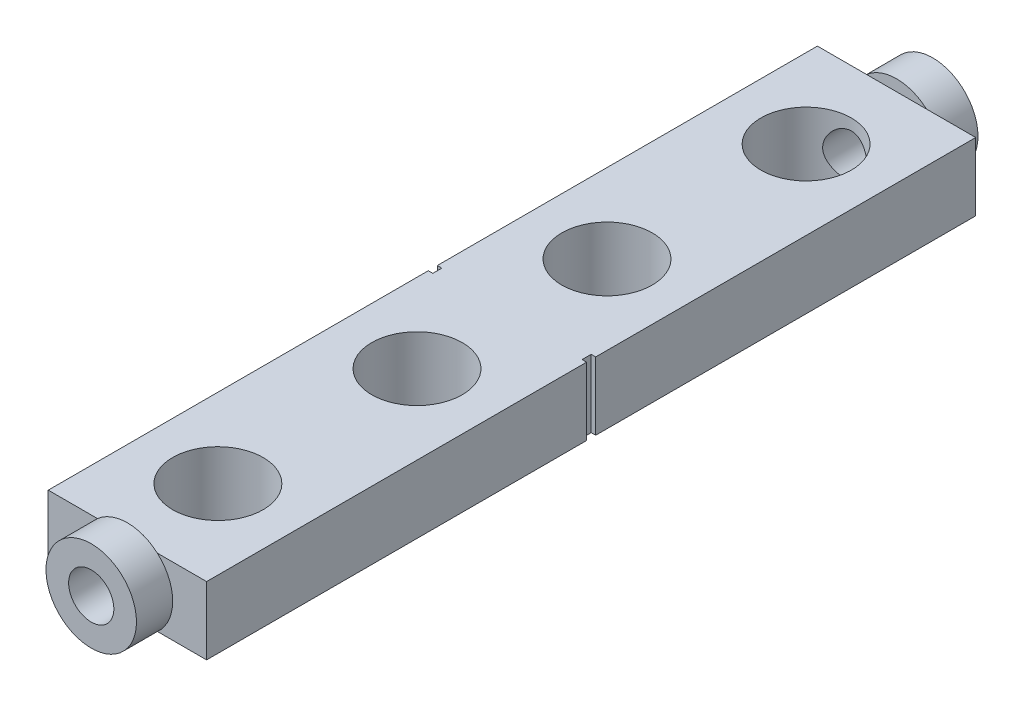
SolidWorks part; units mm, degrees
ref_plane "Face" through (0, 0, 0) normal (0, 0, 1) x (1, 0, 0)
ref_plane "Dessus" through (0, 0, 0) normal (0, 1, 0) x (1, 0, 0)
ref_plane "Droite" through (0, 0, 0) normal (1, 0, 0) x (0, 0, -1)
sketch "Esquisse2" plane through (0, 0, 0) normal (0, 1, 0) x (1, 0, 0)
  line L0 (-1.65, 0) -> (1.65, 0)
  line L1 (1.65, 0) -> (1.65, -0.1)
  line L2 (1.65, -0.1) -> (1.75, -0.1)
  line L3 (1.75, -0.1) -> (1.75, -8.5)
  line L4 (1.75, -8.5) -> (-1.75, -8.5)
  line L5 (-1.75, -8.5) -> (-1.75, -0.1)
  line L6 (-1.75, -0.1) -> (-1.65, -0.1)
  line L7 (-1.65, -0.1) -> (-1.65, 0)
  line L8 (0, 0) -> (0, -8.5) construction
  line L9 (-1.75, -4.3) -> (1.75, -4.3) construction
  circle A0 centre (0, -6.5) radius 1
  circle A1 centre (0, -2.1) radius 1
  dimension "D5" = 2
  dimension "D1" = 3.3
  dimension "D2" = 3.5
  dimension "D3" = 0.1
  dimension "D4" = 8.5
  dimension "D6" = 2
extrude "Extrusion1" add sketch "Esquisse2" along normal mid plane 1.5
sketch "Esquisse3" plane through (0, 0, 8.5) normal (0, 0, 1) x (1, 0, 0)
  circle A0 centre (0, 0) radius 1
  dimension "D1" = 2
extrude "Extrusion2" add sketch "Esquisse3" along normal blind 0.8
sketch "Esquisse6" plane through (0, 0, 9.3) normal (0, 0, 1) x (1, 0, 0)
  circle A0 centre (0, 0) radius 0.5
  dimension "D1" = 1
extrude "Extrusion3" cut sketch "Esquisse6" against normal up to next
mirror "Symétrie1" about plane through (-1.65, 0.75, 0) normal (0, 0, 1)
